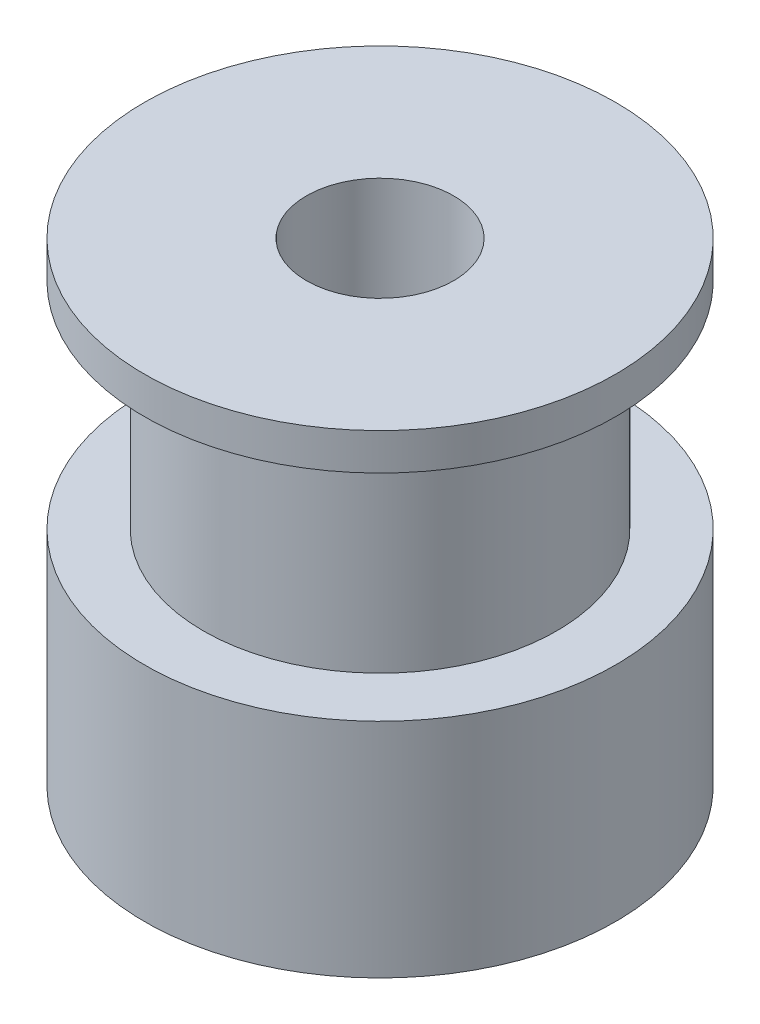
SolidWorks part; units mm, degrees
ref_plane "Alzado" through (0, 0, 0) normal (0, 0, 1) x (1, 0, 0)
ref_plane "Planta" through (0, 0, 0) normal (0, 1, 0) x (1, 0, 0)
ref_plane "Vista lateral" through (0, 0, 0) normal (1, 0, 0) x (0, 0, -1)
sketch "Croquis1" plane through (0, 0, 0) normal (0, 0, 1) x (1, 0, 0)
  line L0 (0, 0) -> (0, 16.1)
  line L1 (0, 16.1) -> (8, 16.1)
  line L2 (8, 16.1) -> (8, 14.85)
  line L3 (8, 14.85) -> (6, 14.85)
  line L4 (6, 14.85) -> (6, 7.55)
  line L5 (6, 7.55) -> (8, 7.55)
  line L6 (0, 0) -> (8, 0)
  line L7 (8, 0) -> (8, 7.55)
  point P10 (0, 0)
  point P11 (0, 0)
  point P12 (-43.1716, 32.5304)
  dimension "D1" = 16.1
  dimension "D2" = 8
  dimension "D3" = 6
  dimension "D4" = 7.3
  dimension "D5" = 8
  dimension "D6" = 1.25
revolve "Revolución1" add sketch "Croquis1" angle 360 about L0
sketch "Croquis2" plane through (0, 16.1, 0) normal (0, 1, 0) x (1, 0, 0)
  circle A0 centre (0, 0) radius 2.5
  dimension "D1" = 5
extrude "Cortar-Extruir1" cut sketch "Croquis2" against normal through all
